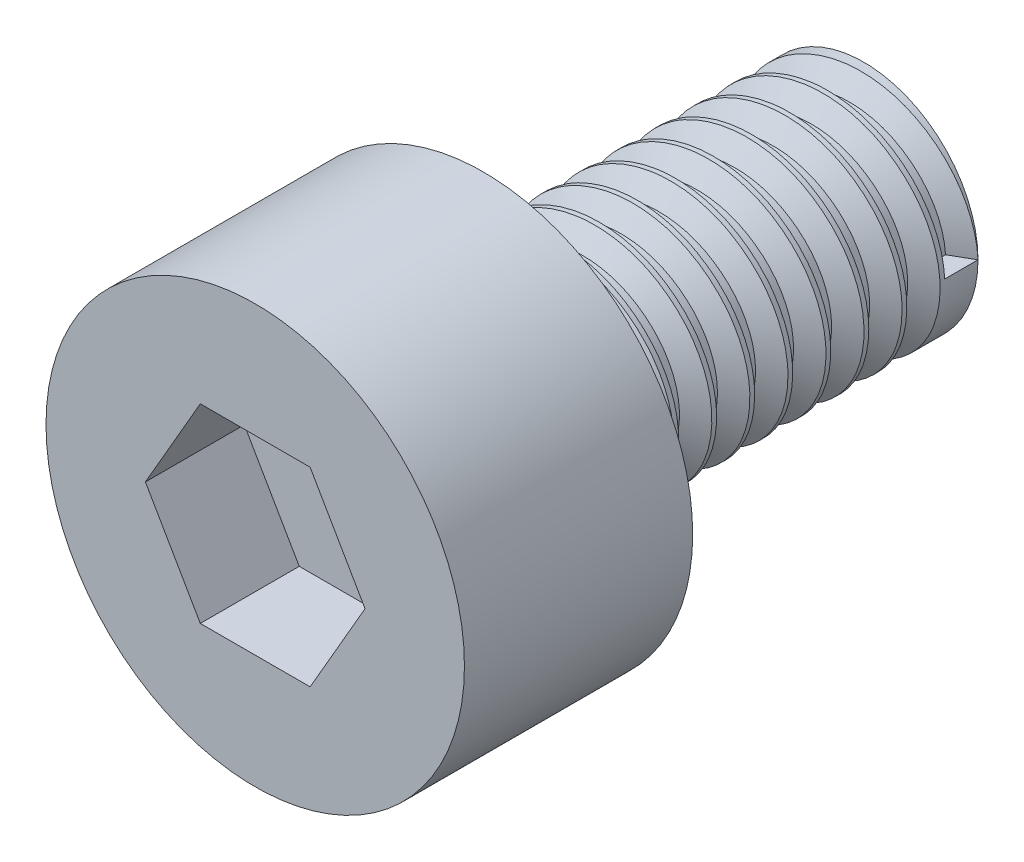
SolidWorks part; units mm, degrees
ref_plane "Front Plane" through (0, 0, 0) normal (0, 0, 1) x (1, 0, 0)
ref_plane "Top Plane" through (0, 0, 0) normal (0, 1, 0) x (1, 0, 0)
ref_plane "Right Plane" through (0, 0, 0) normal (1, 0, 0) x (0, 0, -1)
sketch "Sketch1" plane through (0, 0, 0) normal (0, 0, 1) x (1, 0, 0)
  circle A0 centre (0, 0) radius 1.5
  dimension "D1" = 3
extrude "Boss-Extrude1" add sketch "Sketch1" against normal blind 5
sketch "Sketch2" plane through (0, 0, 0) normal (0, 0, 1) x (1, 0, 0)
  circle A0 centre (0, 0) radius 2.75
  dimension "D1" = 5.5
extrude "Boss-Extrude2" add sketch "Sketch2" along normal blind 3
ref_plane "Mat_dau_vit" through (0, 0, 3) normal (0, 0, 1) x (1, 0, 0)
sketch "Sketch3" plane through (0, 0, 3) normal (0, 0, 1) x (1, 0, 0)
  line L1 (1.4434, 0) -> (0.7217, 1.25)
  line L2 (0.7217, 1.25) -> (-0.7217, 1.25)
  line L3 (-0.7217, 1.25) -> (-1.4434, 0)
  line L4 (-1.4434, 0) -> (-0.7217, -1.25)
  line L5 (-0.7217, -1.25) -> (0.7217, -1.25)
  line L6 (0.7217, -1.25) -> (1.4434, 0)
  circle A0 centre (0, 0) radius 1.25 construction
  dimension "D1" = 2.5
extrude "Cut-Extrude1" cut sketch "Sketch3" against normal blind 1.3
thread "Ren_ngoai_M3x0_5" pitch 0.5 start angle 0, offset 0, length 0, pitch 0.5, diameter 3
ref_plane "Plane2" through (1.5, 0, -5) normal (0, -1, 0) x (1, 0, 0)
sketch "Thread Profile1" plane through (1.5, 0, -5) normal (0, -1, 0) x (1, 0, 0)
  line L0 (0, 0) -> (0, 0.5) construction
  line L11 (0, 0) -> (0, 0.4375)
  line L12 (0, 0.4375) -> (-0.2706, 0.2812)
  line L13 (-0.2706, 0.2812) -> (-0.2706, 0.1562)
  line L15 (-0.2706, 0.1562) -> (0, 0)
  line L17 (-0.2706, 0.2187) -> (0, 0.2187) construction
  point P2 (0, 0)
  dimension "Pitch" = 0.5
  dimension "Profile_Angle" = 60
  dimension "Profile_Land" = 0.125
  dimension "Profile_Height" = 0.2706
